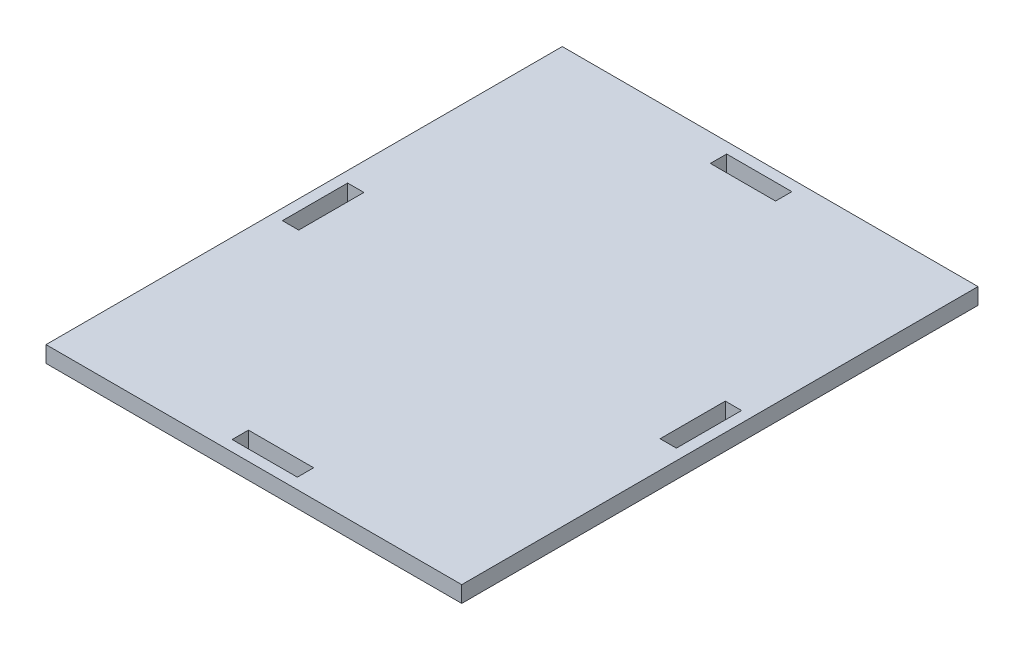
SolidWorks part; units mm, degrees
ref_plane "Front Plane" through (0, 0, 0) normal (0, 0, 1) x (1, 0, 0)
ref_plane "Top Plane" through (0, 0, 0) normal (0, 1, 0) x (1, 0, 0)
ref_plane "Right Plane" through (0, 0, 0) normal (1, 0, 0) x (0, 0, -1)
sketch "Sketch1" plane through (0, 0, 0) normal (0, 1, 0) x (1, 0, 0)
  line L0 (35.5153, 0) -> (-36.25, 0) construction
  line L1 (-36.25, 45.5) -> (36.25, 45.5)
  line L2 (-36.25, 45.5) -> (-36.25, -45.5)
  line L3 (-36.25, -45.5) -> (36.25, -45.5)
  line L4 (36.25, 45.5) -> (36.25, -45.5)
  line L5 (-36.25, 45.5) -> (36.25, -45.5) construction
  line L6 (-36.25, -45.5) -> (36.25, 45.5) construction
  line L7 (-37.7102, 42.5) -> (54.1383, 42.5) construction
  line L8 (0, 45.5) -> (0, -48.3412) construction
  line L9 (6, -45.5) -> (6, -42.5)
  line L10 (-6, 45.5) -> (6, 45.5)
  line L11 (-6, 45.5) -> (-6, 42.5)
  line L12 (-6, 42.5) -> (6, 42.5)
  line L13 (6, 45.5) -> (6, 42.5)
  line L14 (-36.25, 45.5) -> (36.25, 45.5)
  line L15 (-36.25, 45.5) -> (-36.25, 47.5)
  line L16 (-36.25, 47.5) -> (36.25, 47.5)
  line L17 (36.25, 45.5) -> (36.25, 47.5)
  line L18 (-6, -42.5) -> (6, -42.5)
  line L19 (-6, -45.5) -> (-6, -42.5)
  line L20 (-36.25, -45.5) -> (36.25, -45.5)
  line L21 (-36.25, -45.5) -> (-36.25, -47.5)
  line L22 (-36.25, -47.5) -> (36.25, -47.5)
  line L23 (-33.25, 47.5) -> (-33.25, -50.0807) construction
  line L24 (33.25, 6) -> (33.25, -6)
  line L25 (-36.25, 6) -> (-33.25, 6)
  line L26 (-36.25, 6) -> (-36.25, -6)
  line L27 (-36.25, -6) -> (-33.25, -6)
  line L28 (-33.25, 6) -> (-33.25, -6)
  line L29 (-36.25, 45.5) -> (-38.25, 45.5)
  line L30 (-36.25, 45.5) -> (-36.25, -47.5)
  line L31 (-36.25, -47.5) -> (-38.25, -47.5)
  line L32 (-38.25, 45.5) -> (-38.25, -47.5)
  line L33 (36.25, -6) -> (33.25, -6)
  line L34 (36.25, 6) -> (36.25, -6)
  line L35 (36.25, 6) -> (33.25, 6)
  line L36 (38.25, 45.5) -> (38.25, -47.5)
  line L37 (36.25, 47.5) -> (38.25, 47.5)
  line L38 (38.25, 47.5) -> (38.25, 45.5)
  line L39 (36.25, -47.5) -> (38.25, -47.5)
  line L40 (-38.25, 45.5) -> (-38.25, 47.5)
  line L41 (-38.25, 47.5) -> (-36.25, 47.5)
  point P0 (0, 0)
  dimension "D1" = 72.5
  dimension "D2" = 91
  dimension "D3" = 3
  dimension "D4" = 12
  dimension "D5" = 6
  dimension "D6" = 2
  dimension "D7" = 3
  dimension "D8" = 12
  dimension "D9" = 6
  dimension "D10" = 2
extrude "Boss-Extrude2" add sketch "Sketch1" along normal blind 3 contours L35 L4 L1 L13 L12 L11 L2 L25 L28 L27 L3 L19 L18 L9 L33 L24 | L22 L39 L36 L38 L37 L17 L4 L3 L21 | L29 L32 L31 L21 L2 | L1 L17 L16 L15 | L41 L40 L29 L15
